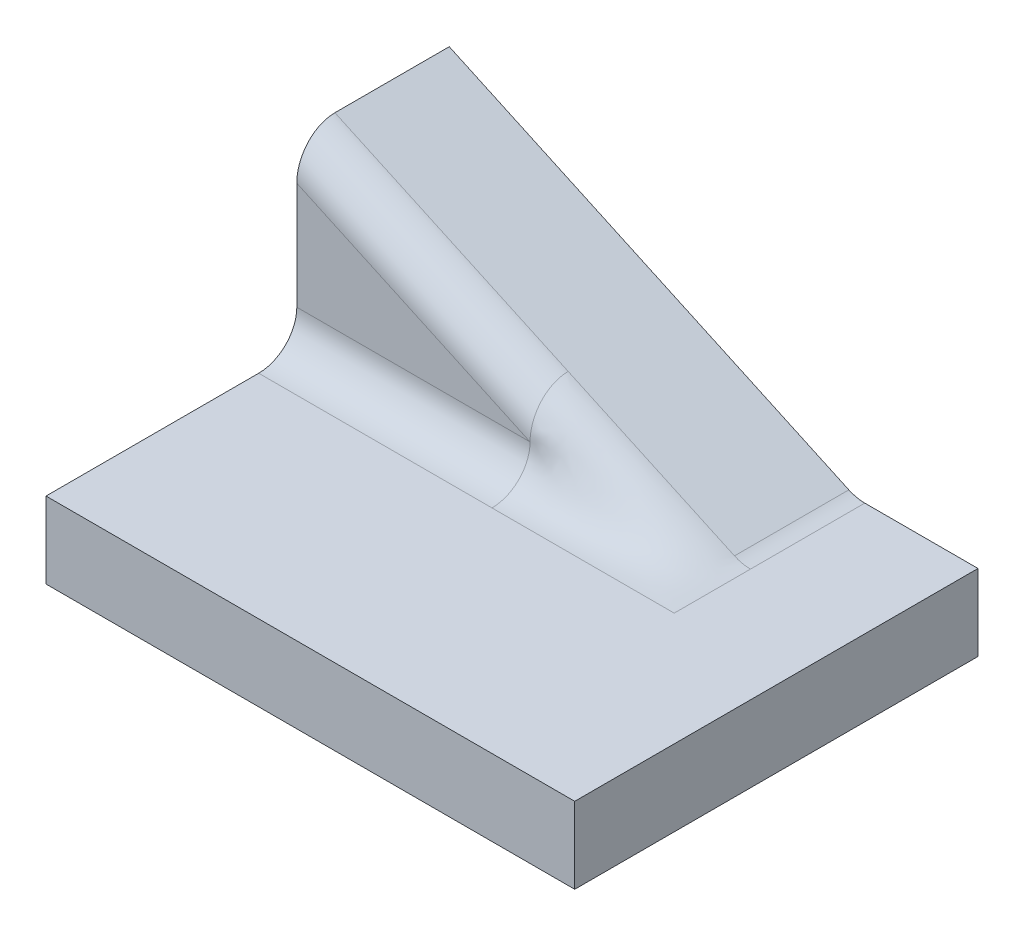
SolidWorks part; units mm, degrees
ref_plane "Front Plane" through (0, 0, 0) normal (0, 0, 1) x (1, 0, 0)
ref_plane "Top Plane" through (0, 0, 0) normal (0, 1, 0) x (1, 0, 0)
ref_plane "Right Plane" through (0, 0, 0) normal (1, 0, 0) x (0, 0, -1)
sketch "Sketch1" plane through (0, 0, 0) normal (0, 1, 0) x (1, 0, 0)
  line L1 (-88.0844, -67.183) -> (88.0844, -67.183)
  line L2 (-88.0844, -67.183) -> (-88.0844, 67.183)
  line L3 (-88.0844, 67.183) -> (88.0844, 67.183)
  line L4 (88.0844, -67.183) -> (88.0844, 67.183)
  line L5 (-88.0844, -67.183) -> (88.0844, 67.183) construction
  line L6 (-88.0844, 67.183) -> (88.0844, -67.183) construction
  point P0 (0, 0)
extrude "Boss-Extrude1" add sketch "Sketch1" along normal blind 25.4
sketch "Sketch2" plane through (0, 0, -67.183) normal (0, 0, -1) x (-1, 0, 0)
  line L0 (-47.5795, 25.4) -> (88.0844, 87.8756)
  line L1 (-88.0844, 25.4) -> (88.0844, 25.4) construction
  line L2 (88.0844, 87.8756) -> (88.0844, 25.4)
  line L3 (88.0844, 25.4) -> (-47.5795, 25.4)
extrude "Boss-Extrude2" add sketch "Sketch2" against normal blind 50.8
fillet "Fillet2" radius 12.7 1 edges at (-20.2525, 56.6378, -16.383)
fillet "Fillet1" radius 12.7 3 edges at (38.6868, 25.4, -20.1028)
sketch "Sketch4" plane through (0, 25.4, 0) normal (0, 1, 0) x (1, 0, 0)
  line L0 (-10.3597, 3.683) -> (-10.3597, 29.083)
  line L1 (-88.0844, 29.083) -> (45.0509, 29.083) construction
  line L2 (-10.3597, 3.683) -> (50.3633, 3.683)
  line L3 (50.3633, 3.683) -> (50.3633, 29.083)
other "DeleteFace2"
